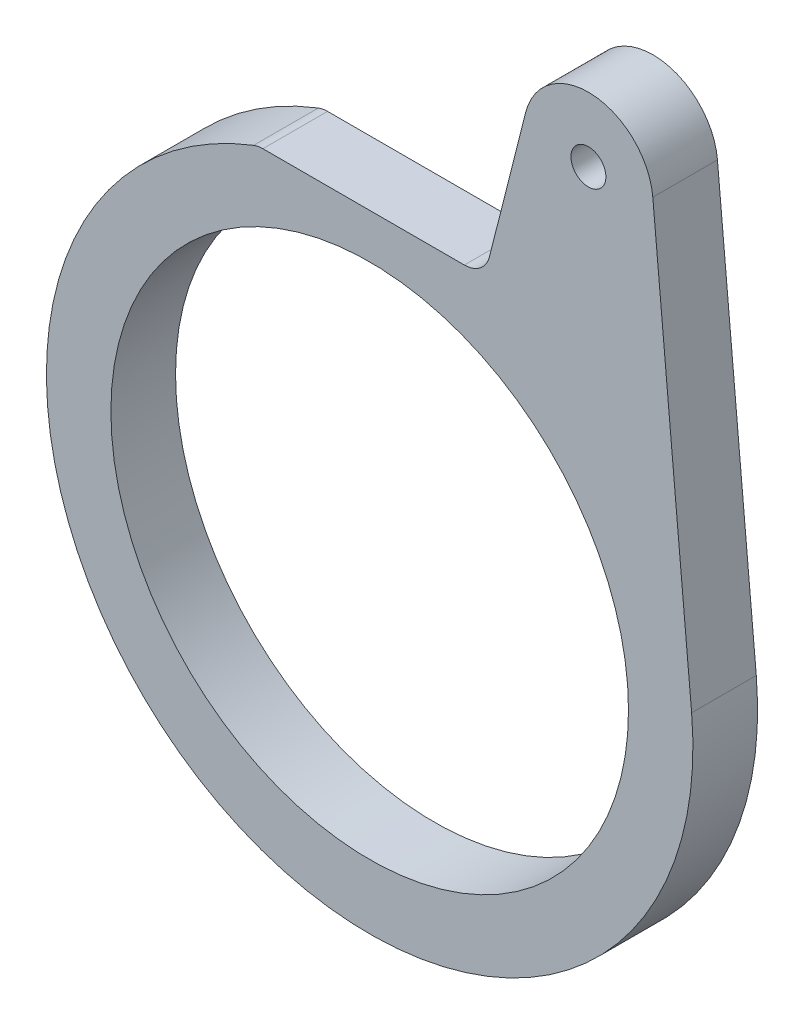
SolidWorks part; units mm, degrees
ref_plane "Front Plane" through (0, 0, 0) normal (0, 0, 1) x (1, 0, 0)
ref_plane "Top Plane" through (0, 0, 0) normal (0, 1, 0) x (1, 0, 0)
ref_plane "Right Plane" through (0, 0, 0) normal (1, 0, 0) x (0, 0, -1)
sketch "Sketch1" plane through (0, 0, 0) normal (0, 0, 1) x (1, 0, 0)
  line L0 (63.2392, 5.7493) -> (55.6119, 89.6455)
  line L1 (30.6526, 91.613) -> (22.5476, 59.6032)
  line L2 (22.5476, 59.6032) -> (-21.9024, 59.6032)
  arc A0 (-21.9024, 59.6032) -> (63.2392, 5.7493) centre (0, 0) ccw
  arc A1 (55.6119, 89.6455) -> (30.6526, 91.613) centre (42.9641, 88.4957) ccw
  circle A2 centre (42.9641, 88.4957) radius 3.429
  circle A3 centre (0, 0) radius 50.8381
  dimension "D1" = 6.858
  dimension "D2" = 127
  dimension "D3" = 12.7
  dimension "D4" = 101.6762
  dimension "D5" = 42.9641
  dimension "D6" = 88.4957
  dimension "D7" = 44.45
  dimension "D8" = 33.02
extrude "Boss-Extrude1" add sketch "Sketch1" along normal mid plane 12.7
fillet "Fillet1" radius 5.08 2 edges at (22.5476, 59.6032, 0) (-21.9024, 59.6032, 0)
